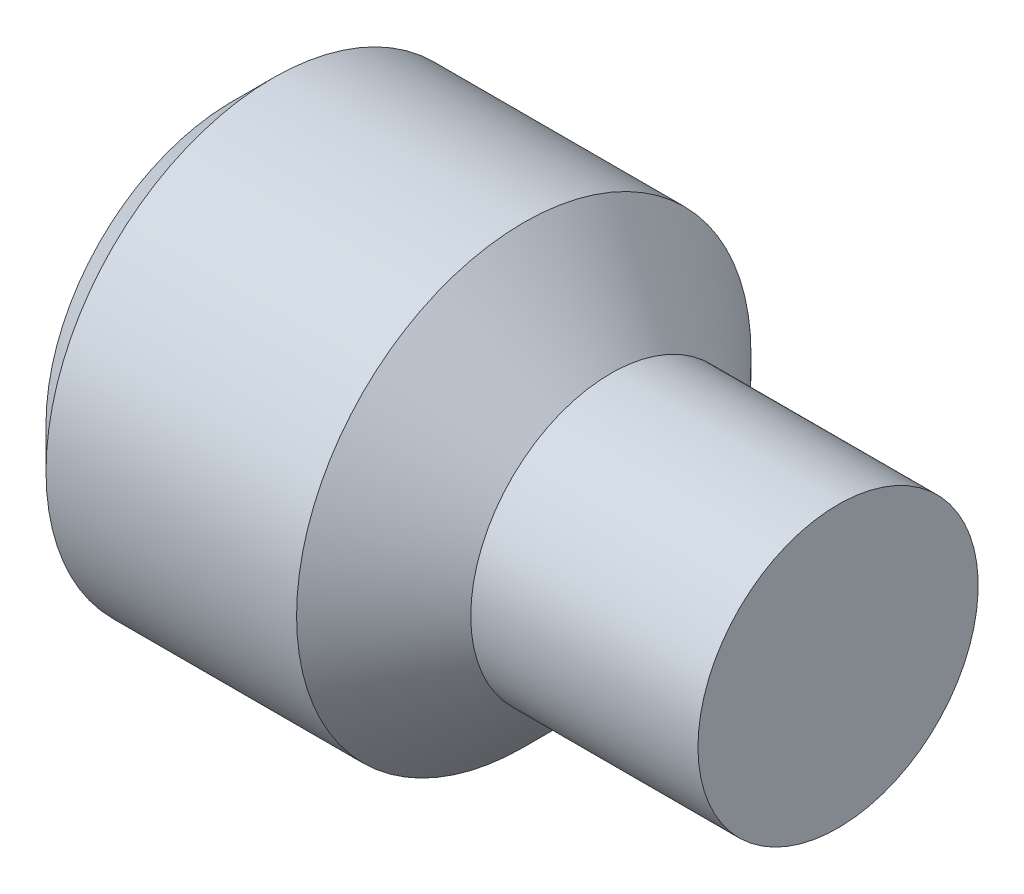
SolidWorks part; units mm, degrees
ref_plane "Front" through (0, 0, 0) normal (0, 0, 1) x (1, 0, 0)
ref_plane "Top" through (0, 0, 0) normal (0, 1, 0) x (1, 0, 0)
ref_plane "Right" through (0, 0, 0) normal (1, 0, 0) x (0, 0, -1)
sketch "Sketch1" plane through (0, 0, 0) normal (0, 0, 1) x (1, 0, 0)
  line L0 (0, 0) -> (8, 0)
  line L1 (8, 0) -> (8, 1.85)
  line L2 (3.85, 3) -> (5, 1.85)
  line L3 (3.85, 3) -> (0.5415, 3)
  line L4 (0.5415, 3) -> (0, 2.4585)
  line L5 (0, 2.4585) -> (0, 0)
  line L6 (-1.9688, 0) -> (10.951, 0) construction
  line L7 (8, 1.85) -> (5, 1.85)
  dimension "D1" = 45
  dimension "l" = 8
  dimension "D2" = 45
  dimension "dp" = 3.7
  dimension "d" = 6
  dimension "df" = 4.917
  dimension "z" = 3
revolve "Base" add sketch "Sketch1" angle 360 about L6
sketch "Sketch2" plane through (0, -1.1285, -0.3504) normal (-1, 0, 0) x (0, 0, 1)
  line L1 (2.094, 1.1285) -> (1.2222, 2.6385)
  line L2 (1.2222, 2.6385) -> (-0.5214, 2.6385)
  line L3 (-0.5214, 2.6385) -> (-1.3932, 1.1285)
  line L4 (-1.3932, 1.1285) -> (-0.5214, -0.3815)
  line L5 (-0.5214, -0.3815) -> (1.2222, -0.3815)
  line L6 (1.2222, -0.3815) -> (2.094, 1.1285)
  circle A0 centre (0.3504, 1.1285) radius 1.51 construction
  dimension "s" = 3.02
  dimension "e" = 3.4872
extrude "HexagonSocket" cut sketch "Sketch2" against normal blind 2
sketch "Sketch3" plane through (0, 0, 0) normal (0, 0, 1) x (1, 0, 0)
  line L0 (2, 1.51) -> (2, 0)
  line L1 (2, 0) -> (2.4, 0)
  line L3 (2.4, 0) -> (2, 1.51)
  line L4 (-0.331, 0) -> (6.7238, 0) construction
  dimension "h" = 0.4
revolve "Cut-Revolve1" cut sketch "Sketch3" angle 360 about L4
sketch "Sketch4" plane through (0, 0, 0) normal (0, 0, 1) x (1, 0, 0)
  line L0 (0.5415, 2.531) -> (0.8123, 3)
  line L1 (0.8123, 3) -> (0.8123, 3.5415)
  line L2 (0.8123, 3.5415) -> (0.2708, 3.5415)
  line L3 (0.2708, 3.5415) -> (0.2708, 3)
  line L4 (0.2708, 3) -> (0.5415, 2.531)
  line L5 (0, 0) -> (2.4831, 0) construction
  line L6 (0.5415, 3) -> (0.5415, -3) construction
  dimension "D1" = 6
  dimension "D2" = 0.5415
revolve "Cut-Revolve10" [suppressed] cut sketch "Sketch4" angle 360 about L5
pattern_linear "LPattern10" [suppressed] count 7 spacing 0.6498 along (1, 0, 0)
equation "\"df@Sketch1\" = \"D2@ThreadCosmetic1\""
equation "\"h@Sketch3\" = 0.2 * \"t@HexagonSocket\""
equation "\"D1@Sketch4\" = \"d@Sketch1\""
equation "\"D2@Sketch4\" =  ( \"d@Sketch1\" - \"D2@ThreadCosmetic1\" )  / 2"
equation "\"D3@LPattern10\" = \"D2@Sketch4\" * 1.2"
equation "\"D1@LPattern10\" =  ( \"l@Sketch1\" - \"z@Sketch1\" -  ( \"d@Sketch1\" - \"df@Sketch1\" )  / 2 )  / \"D3@LPattern10\""
